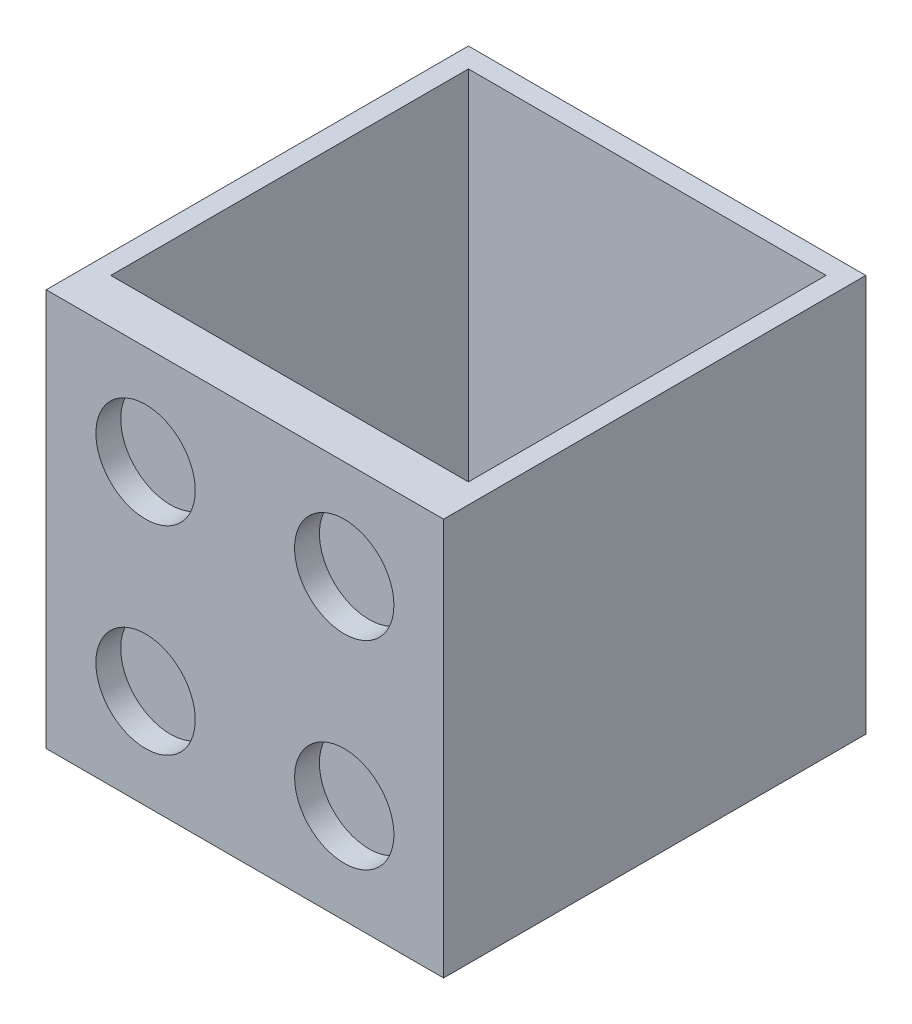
SolidWorks part; units mm, degrees
ref_plane "Front Plane" through (0, 0, 0) normal (0, 0, 1) x (1, 0, 0)
ref_plane "Top Plane" through (0, 0, 0) normal (0, 1, 0) x (1, 0, 0)
ref_plane "Right Plane" through (0, 0, 0) normal (1, 0, 0) x (0, 0, -1)
sketch "Sketch1" plane through (0, 0, 0) normal (0, 0, 1) x (1, 0, 0)
  line L1 (0, 0) -> (50.8, 0)
  line L2 (0, 0) -> (0, 50.8)
  line L3 (0, 50.8) -> (50.8, 50.8)
  line L4 (50.8, 0) -> (50.8, 50.8)
  dimension "D1" = 50.8
  dimension "D2" = 50.8
extrude "Boss-Extrude1" add sketch "Sketch1" along normal blind 53.975
sketch "Sketch3" plane through (0, 0, 53.975) normal (0, 0, 1) x (1, 0, 0)
  line L0 (0, 50.8) -> (0, 0) construction
  line L1 (50.8, 50.8) -> (0, 50.8) construction
  line L2 (0, 0) -> (50.8, 0) construction
  line L3 (25.4, 50.8) -> (25.4, 0)
  line L5 (12.7, 152.4) -> (12.7, 0)
  line L6 (38.1, 50.8) -> (38.1, 0)
  line L7 (50.8, 50.8) -> (50.8, 0)
  line L8 (63.5, 50.8) -> (63.5, 0)
  line L9 (76.2, 50.8) -> (76.2, 0)
  line L10 (88.9, 50.8) -> (88.9, 0)
  line L11 (0, 12.7) -> (50.8, 12.7)
  line L12 (50.8, 0) -> (50.8, 50.8) construction
  line L13 (0, 25.4) -> (50.8, 25.4)
  line L14 (0, 38.1) -> (50.8, 38.1)
  line L15 (0, 50.8) -> (50.8, 50.8)
  line L16 (0, 63.5) -> (50.8, 63.5)
  line L17 (0, 63.6141) -> (50.8, 63.6141)
  line L18 (0, 76.2) -> (50.8, 76.2)
  line L19 (0, 88.9) -> (50.8, 88.9)
  line L20 (0, 101.6) -> (50.8, 101.6)
  line L21 (0, 114.3) -> (50.8, 114.3)
  line L22 (0, 127) -> (50.8, 127)
  line L23 (0, 139.7) -> (50.8, 139.7)
  circle A0 centre (12.7, 139.7) radius 6.35
  circle A2 centre (38.1, 139.7) radius 6.35
  circle A4 centre (63.5, 139.7) radius 2.54
  circle A6 centre (88.9, 139.7) radius 2.54
  circle A7 centre (88.9, 114.3) radius 2.54
  circle A8 centre (63.5, 114.3) radius 2.54
  circle A9 centre (38.1, 114.3) radius 6.35
  circle A10 centre (12.7, 114.3) radius 6.35
  circle A11 centre (88.9, 88.9) radius 2.54
  circle A12 centre (63.5, 88.9) radius 2.54
  circle A13 centre (38.1, 88.9) radius 6.35
  circle A14 centre (12.7, 88.9) radius 6.35
  circle A15 centre (88.9, 63.5) radius 2.54
  circle A16 centre (63.5, 63.5) radius 2.54
  circle A17 centre (38.1, 63.5) radius 6.35
  circle A18 centre (12.7, 63.5) radius 6.35
  circle A19 centre (88.9, 38.1) radius 2.54
  circle A20 centre (63.5, 38.1) radius 2.54
  circle A21 centre (38.1, 38.1) radius 6.35
  circle A22 centre (12.7, 38.1) radius 6.35
  circle A23 centre (88.9, 12.7) radius 2.54
  circle A24 centre (63.5, 12.7) radius 2.54
  circle A25 centre (38.1, 12.7) radius 6.35
  circle A26 centre (12.7, 12.7) radius 6.35
  dimension "D1" = 12.7
  dimension "D2" = 12.7
  dimension "D3" = 12.7
  dimension "D4" = 12.7
  dimension "D5" = 12.7
  dimension "D6" = 12.7
  dimension "D7" = 12.7
  dimension "D8" = 12.7
  dimension "D9" = 12.7
  dimension "D10" = 12.7
  dimension "D11" = 12.7
  dimension "D12" = 12.7
  dimension "D13" = 12.7
  dimension "D14" = 12.7
  dimension "D15" = 12.7
  dimension "D16" = 12.7
  dimension "D17" = 12.7
  dimension "D18" = 12.7
extrude "Cut-Extrude2" cut sketch "Sketch3" against normal blind 3.175 contours A0 | A2 | A4 | A6 | A7 | A8 | A9 | A10 | A14 | A13 | A12 | A11 | A18 | A17 | A16 | A15 | A22 | A21 | A20 | A19 | A26 | A25 | A24 | A23
sketch "Sketch4" plane through (0, 50.8, 0) normal (0, 1, 0) x (1, 0, 0)
  line L0 (2.54, -2.54) -> (2.54, -48.26)
  line L1 (2.54, -48.26) -> (48.26, -48.26)
  line L2 (48.26, -48.26) -> (48.26, -2.54)
  line L3 (48.26, -2.54) -> (2.54, -2.54)
  line L4 (0, -53.975) -> (0, 0) construction
  line L5 (50.8, 0) -> (0, 0) construction
  line L6 (50.8, -53.975) -> (50.8, 0) construction
  line L7 (50.8, -53.975) -> (0, -53.975) construction
  dimension "D1" = 2.54
  dimension "D2" = 2.54
  dimension "D3" = 2.54
  dimension "D4" = 5.715
extrude "Cut-Extrude3" cut sketch "Sketch4" against normal blind 48.26
